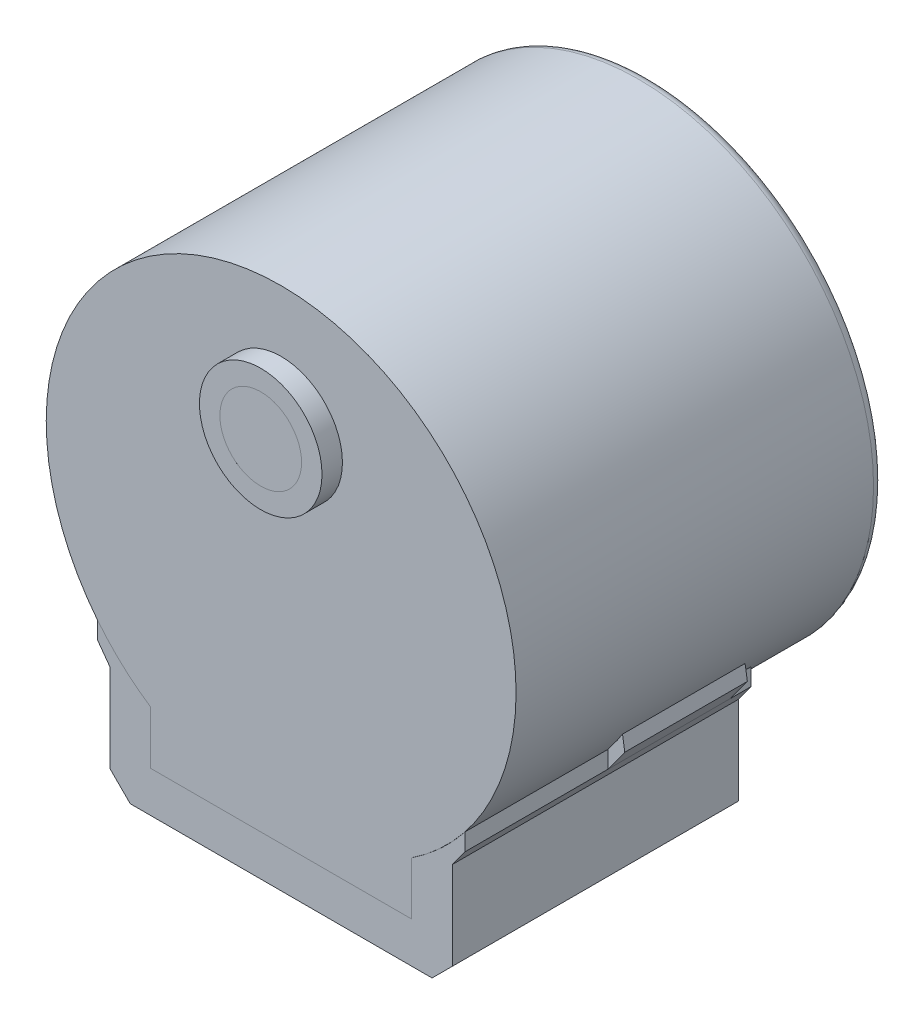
SolidWorks part; units mm, degrees
ref_plane "Front Plane" through (0, 0, 0) normal (0, 0, 1) x (1, 0, 0)
ref_plane "Top Plane" through (0, 0, 0) normal (0, 1, 0) x (1, 0, 0)
ref_plane "Right Plane" through (0, 0, 0) normal (1, 0, 0) x (0, 0, -1)
sketch "Sketch1" plane through (0, 0, 0) normal (0, 0, 1) x (1, 0, 0)
  circle A0 centre (0, 0) radius 11.5
  dimension "D1" = 23
extrude "Boss-Extrude1" add sketch "Sketch1" along normal blind 18
sketch "Sketch2" plane through (0, 0, 18) normal (0, 0, 1) x (1, 0, 0)
  line L0 (0, 14.8265) -> (0, -25.2006) construction
  line L2 (-9, -7.1589) -> (9, -7.1589)
  line L3 (-9, -7.1589) -> (-9, -8.0014)
  line L4 (-8.3881, -14.1589) -> (8.3881, -14.1589)
  line L5 (9, -7.1589) -> (9, -8.0014)
  line L6 (-8.3881, -8.8439) -> (-9, -8.0014)
  line L7 (8.3881, -8.8439) -> (9, -8.0014)
  line L9 (-8.3881, -14.1589) -> (-8.3881, -8.8439)
  line L10 (8.3881, -14.1589) -> (8.3881, -8.8439)
  circle A0 centre (0, 0) radius 11.5 construction
  dimension "D1" = 18
extrude "Boss-Extrude4" add sketch "Sketch2" against normal blind 14
chamfer "Chamfer2" distance 1 angle 45 2 edges at (8.3881, -14.1589, 11) (-8.3881, -14.1589, 11)
sketch "Sketch3" plane through (0, 0, 18) normal (0, 0, 1) x (1, 0, 0)
  line L0 (-16.1014, 0) -> (16.1534, 0) construction
ref_plane "Plane1" through (0, 0, 5) normal (0, 0, -1) x (-1, 0, 0)
sketch "Sketch4" plane through (0, 0, 5) normal (0, 0, -1) x (-1, 0, 0)
  line L0 (-9, -8.0014) -> (-9.8226, -6.8688)
  line L1 (-9.8226, -6.8688) -> (-9.7104, -6.1611)
  line L2 (-9.7104, -6.1611) -> (-9, -7.1589)
  line L3 (-9, -7.1589) -> (-9, -8.0014)
  line L4 (0, 16.9109) -> (0, -16.5912) construction
  line L5 (9, -7.1589) -> (9, -8.0014)
  line L6 (9.7104, -6.1611) -> (9, -7.1589)
  line L7 (9.8226, -6.8688) -> (9.7104, -6.1611)
  line L8 (9, -8.0014) -> (9.8226, -6.8688)
  circle A0 centre (0, 0) radius 11.5 construction
extrude "Boss-Extrude5" add sketch "Sketch4" against normal blind 6 separate body
fillet "Fillet1" radius 0.5 1 edges at (11.5, 0, 0)
ref_plane "Plane2" through (0, 0, 18) normal (0, 0, 1) x (1, 0, 0)
sketch "Sketch9" plane through (0, 0, 18) normal (0, 0, 1) x (1, 0, 0)
  line L0 (8.3881, -13.1589) -> (8.3881, -8.8439) construction
  line L2 (-6.3881, -9.5625) -> (-6.3881, -12.1589)
  line L3 (-6.3881, -12.1589) -> (6.3881, -12.1589)
  line L4 (6.3881, -9.5625) -> (6.3881, -12.1589)
  line L5 (-8.3881, -8.8439) -> (-8.3881, -13.1589) construction
  line L6 (-7.3881, -14.1589) -> (7.3881, -14.1589) construction
  arc A0 (6.3881, -9.5625) -> (-6.3881, -9.5625) centre (0, 0) ccw
  dimension "D1" = 2
  dimension "D2" = 2
  dimension "D3" = 2
extrude "Boss-Extrude9" add sketch "Sketch9" along normal blind 0.0001
sketch "Sketch10" plane through (0, 0, 18.0001) normal (0, 0, 1) x (1, 0, 0)
  line L0 (-30.5576, 0) -> (32.961, 0) construction
  circle A0 centre (0, 5.5) radius 3
  dimension "D2" = 6
  dimension "D1" = 5.5
extrude "Boss-Extrude10" add sketch "Sketch10" along normal blind 1 contours A0
sketch "Sketch12" plane through (0, 0, 19.0001) normal (0, 0, 1) x (1, 0, 0)
  circle A0 centre (0, 5.5) radius 2
  dimension "D1" = 4
extrude "Cut-Extrude2" cut sketch "Sketch12" against normal blind 1
sketch "Sketch5" plane through (0, 0, 0) normal (0, 0, 1) x (1, 0, 0)
  line L0 (0, 13.7307) -> (0, -15.6745) construction
sketch "Sketch6" plane through (0, 0, 18) normal (0, 0, 1) x (1, 0, 0)
  line L0 (0, 13.7307) -> (0, -15.6745) construction
  line L1 (-16.1014, 0) -> (16.1534, 0) construction
  circle A0 centre (0, 5.5) radius 3
  dimension "D1" = 6
  dimension "D2" = 5.5
extrude "Boss-Extrude6" add sketch "Sketch6" along normal blind 1
sketch "Sketch13" plane through (0, 0, 0) normal (0, 0, -1) x (-1, 0, 0)
  circle A0 centre (0, 0) radius 10.3264
extrude "Boss-Extrude11" add sketch "Sketch13" along normal blind 0.001
sketch "Sketch15" plane through (0, 0, -0.001) normal (0, 0, -1) x (-1, 0, 0)
  text T0 "RoHS" font "Century Gothic" height 3.5
extrude "Boss-Extrude13" add sketch "Sketch15" along normal blind 0.0001
sketch "Sketch16" plane through (0, 0, -0.001) normal (0, 0, -1) x (-1, 0, 0)
  text T0 "24BYJ48" font "Century Gothic" height 3.5
extrude "Boss-Extrude14" add sketch "Sketch16" along normal blind 0.0001
sketch "Sketch17" plane through (0, 0, -0.001) normal (0, 0, -1) x (-1, 0, 0)
  text T0 "12V DC" font "Century Gothic" height 3.5
extrude "Boss-Extrude15" add sketch "Sketch17" along normal blind 0.0001
